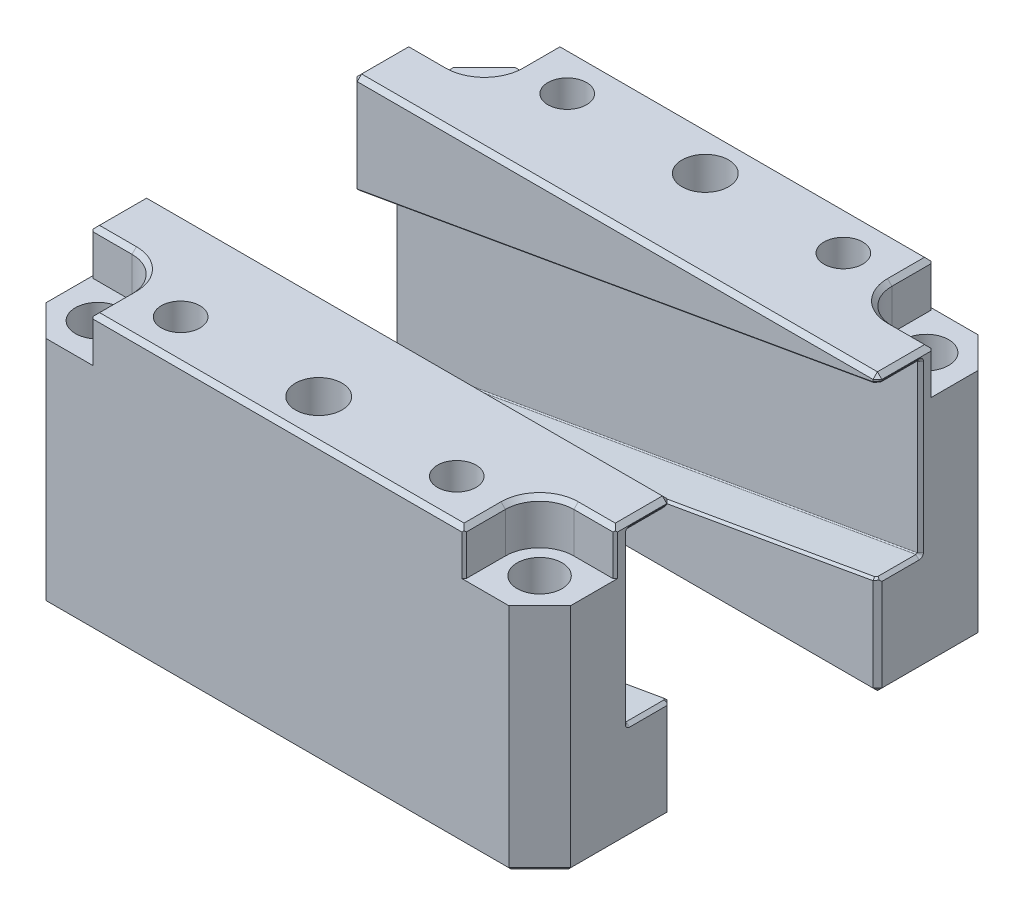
SolidWorks part; units mm, degrees
ref_plane "Front Plane" through (0, 0, 0) normal (0, 0, 1) x (1, 0, 0)
ref_plane "Top Plane" through (0, 0, 0) normal (0, 1, 0) x (1, 0, 0)
ref_plane "Right Plane" through (0, 0, 0) normal (1, 0, 0) x (0, 0, -1)
sketch "Sketch1" plane through (0, 0, 0) normal (1, 0, 0) x (0, 0, -1)
  line L0 (-23.7109, 0) -> (-23.7109, 63.5)
  line L1 (-23.7109, 63.5) -> (-53.9496, 63.5)
  line L2 (-53.9496, 63.5) -> (-53.9496, 0)
  line L3 (-53.9496, 0) -> (-23.7109, 0)
  line L4 (0, 48.255) -> (0, -16.2311) construction
  dimension "D1" = 47.4218
  dimension "D2" = 63.5
  dimension "D3" = 107.8992
  dimension "D4" = 30.2387
extrude "Boss-Extrude1" add sketch "Sketch1" along normal mid plane 120.65
hole_wizard "CBORE for 3/8 Socket Head Cap Screw3" positions "Sketch4" profile "Sketch3" counterbore size "3/8" standard "ANSI Inch"
sketch "Sketch4" plane through (0, 63.5, 0) normal (0, 1, 0) x (1, 0, 0)
  line L0 (0, 7.4267) -> (0, -36.2312) construction
  line L2 (-19.6518, 0) -> (14.0148, 0) construction
  point P0 (-50.8, -44.45)
  point P11 (50.8, -44.45)
  dimension "D1" = 101.6
  dimension "D2" = 88.9
sketch "Sketch3" plane through (-50.8, 63.5, 44.45) normal (1, 0, 0) x (0, 0, 1)
  line L0 (0, 0) -> (0, 63.5)
  line L1 (0, 63.5) -> (5.1587, 63.5)
  line L3 (5.1587, 63.5) -> (5.1587, 10.287)
  line L4 (5.1587, 10.287) -> (7.874, 10.287)
  line L5 (7.874, 10.287) -> (7.874, 0)
  line L7 (7.874, 0) -> (0, 0)
  line L11 (0, -6.35) -> (0, 107.95) construction
  dimension "Thru Hole Dia." = 10.3175
  dimension "Thru Hole Depth" = 63.5
  dimension "C'Bore Dia." = 15.748
  dimension "C'Bore Depth" = 10.287
hole_wizard "1/2-13 Tapped Hole1" positions "Sketch6" profile "Sketch5" tap size "1/2-13" standard "ANSI Inch"
sketch "Sketch6" plane through (0, 63.5, 0) normal (0, 1, 0) x (1, 0, 0)
  line L0 (0, 2.7703) -> (0, -32.9614) construction
  line L2 (-8.3627, 0) -> (4.6629, 0) construction
  line L4 (50.8, -44.45) -> (-50.8, -44.45) construction
  point P2 (0, -44.45)
sketch "Sketch5" plane through (0, 63.5, 44.45) normal (1, 0, 0) x (0, 0, 1)
  line L0 (0, 0) -> (0, 38.3985)
  line L1 (0, 38.3985) -> (5.3581, 35.179)
  line L2 (5.3581, 35.179) -> (5.3581, 0)
  line L5 (5.3581, 0) -> (0, 0)
  line L10 (0, 38.3985) -> (-5.3581, 35.179) construction
  line L11 (0, -6.35) -> (0, 107.95) construction
  dimension "Tap Drill Dia." = 10.7163
  dimension "Tap Drill Depth" = 35.179
  dimension "Drill Angle" = 118
chamfer "Chamfer1" distance 7.112 angle 45 2 edges at (60.325, 31.75, 53.9496) (-60.325, 31.75, 53.9496)
ref_plane "Plane3" through (0, 0, 44.45) normal (0, 0, 1) x (1, 0, 0)
sketch "Sketch17" plane through (0, 0, 44.45) normal (0, 0, 1) x (1, 0, 0)
  line L0 (-36.195, 63.5) -> (-36.195, 22.7968)
  line L1 (-36.195, 22.7968) -> (-36.5125, 22.606)
  line L2 (-36.5125, 22.606) -> (-36.5125, 0)
  line L3 (-36.5125, 0) -> (-31.75, 0)
  line L4 (-31.75, 0) -> (-31.75, 63.5)
  line L5 (-31.75, 63.5) -> (-36.195, 63.5)
  line L6 (-31.75, 71.3814) -> (-31.75, -4.206) construction
  line L7 (53.213, 0) -> (-53.213, 0) construction
  line L8 (53.213, 63.5) -> (-53.213, 63.5) construction
  line L9 (0, 0) -> (0, 70.256) construction
  dimension "D1" = 22.606
  dimension "D2" = 59
  dimension "D3" = 9.525
  dimension "D4" = 8.89
  dimension "D5" = 63.5
revolve "Cut-Revolve2" cut sketch "Sketch17" angle 360 about L6
mirror "Mirror1" about plane through (0, 0, 0) normal (1, 0, 0) of "Cut-Revolve2"
sketch "Sketch8" plane through (0, 63.5, 0) normal (0, 1, 0) x (1, 0, 0)
  line L0 (-50.8, -36.576) -> (-60.325, -36.576)
  line L2 (-60.325, -23.7109) -> (-60.325, -46.8376) construction
  line L3 (-60.325, -36.576) -> (-60.325, -53.9496)
  line L4 (-60.325, -53.9496) -> (-42.926, -53.9496)
  line L5 (53.213, -53.9496) -> (-53.213, -53.9496) construction
  line L6 (-42.926, -53.9496) -> (-42.926, -44.45)
  line L7 (0, -17.5035) -> (0, -67.3559) construction
  line L8 (42.926, -53.9496) -> (42.926, -44.45)
  line L9 (60.325, -53.9496) -> (42.926, -53.9496)
  line L10 (60.325, -36.576) -> (60.325, -53.9496)
  line L11 (50.8, -36.576) -> (60.325, -36.576)
  circle A0 centre (-50.8, -44.45) radius 7.874 construction
  circle A1 centre (-50.8, -44.45) radius 7.874 construction
  arc A2 (-42.926, -44.45) -> (-50.8, -36.576) centre (-50.8, -44.45) ccw
  arc A3 (42.926, -44.45) -> (50.8, -36.576) centre (50.8, -44.45) cw
extrude "Cut-Extrude3" cut sketch "Sketch8" against normal up to surface (10.287 mm away)
sketch "Sketch9" plane through (0, 0, 23.7109) normal (0, 0, -1) x (-1, 0, 0)
  line L0 (0, 63.5) -> (0, 0) construction
  line L1 (-60.325, 63.5) -> (60.325, 63.5) construction
  line L2 (60.325, 0) -> (60.325, 63.5) construction
  line L3 (-60.325, 61.6792) -> (60.325, 40.4054)
  line L4 (-60.325, 61.6792) -> (-60.325, 23.0946)
  line L5 (-60.325, 23.0946) -> (60.325, 1.8208)
  line L6 (60.325, 40.4054) -> (60.325, 1.8208)
  line L7 (-60.325, 61.6792) -> (60.325, 1.8208) construction
  line L8 (-60.325, 23.0946) -> (60.325, 40.4054) construction
  line L9 (12.9005, 31.75) -> (-13.5117, 31.75) construction
  point P5 (0, 31.75)
  dimension "D1" = 37.9984
  dimension "D2" = 10
extrude "Cut-Extrude4" cut sketch "Sketch9" against normal offset from surface (9.8425 mm away) 33.5534
hole_wizard "1/2-13 Tapped Hole2" positions "Sketch11" profile "Sketch10" tap size "1/2-13" standard "ANSI Inch"
sketch "Sketch11" plane through (0, 0, 0) normal (0, -1, 0) x (-1, 0, 0)
  point P0 (50.8, -44.45)
  point P3 (-50.8, -44.45)
sketch "Sketch10" plane through (-50.8, 0, 44.45) normal (1, 0, 0) x (0, 0, -1)
  line L0 (0, 0) -> (0, 38.3985)
  line L1 (0, 38.3985) -> (5.3581, 35.179)
  line L2 (5.3581, 35.179) -> (5.3581, 0)
  line L5 (5.3581, 0) -> (0, 0)
  line L10 (0, 38.3985) -> (-5.3581, 35.179) construction
  line L11 (0, -6.35) -> (0, 107.95) construction
  dimension "Tap Drill Dia." = 10.7163
  dimension "Tap Drill Depth" = 35.179
  dimension "Drill Angle" = 118
ref_plane "Plane1" through (-5.4296, 30.7926, 0) normal (-0.1736, 0.9848, 0) x (0.9848, 0.1736, 0)
fillet "Fillet1" radius 0.254 2 edges at (0, 12.4577, 33.5534) (0, 51.0423, 33.5534)
chamfer "Chamfer2" distance 1.016 angle 45 20 edges at (0, 0, 23.7109) (60.325, 11.5473, 23.7109) (60.325, 0, 35.2742) (56.769, 0, 50.3936) (0, 0, 53.9496) (-56.769, 0, 50.3936) (-60.325, 0, 35.2742) (-60.325, 0.9104, 23.7109) (-45.2322, 63.5, 38.8822) (-60.325, 63.5, 30.1434) (-60.325, 51.9527, 23.7109) (0, 63.5, 23.7109) (0, 63.5, 53.9496) (45.2322, 63.5, 38.8822) (60.325, 63.5, 30.1434) (60.325, 62.5896, 23.7109) (-42.926, 63.5, 49.1998) (-55.5625, 63.5, 36.576) (42.926, 63.5, 49.1998) (55.5625, 63.5, 36.576)
chamfer "Chamfer3" distance 0.508 angle 45 20 edges at (-59.817, 1.9104, 24.2189) (0, 12.4577, 23.7109) (59.817, 23.0051, 24.2189) (-60.325, 1.8208, 29.0132) (60.325, 23.0946, 29.0132) (-60.325, 1.8963, 33.479) (60.325, 23.1702, 33.479) (-60.325, 21.1131, 33.5534) (60.325, 42.3869, 33.5534) (-60.325, 40.3298, 33.479) (60.325, 61.6037, 33.479) (-60.325, 40.4054, 29.0132) (-59.817, 40.4949, 24.2189) (0, 51.0423, 23.7109) (59.817, 61.5896, 24.2189) (60.325, 61.6792, 29.0132) (60.325, 57.8485, 36.576) (42.926, 57.8485, 53.9496) (-42.926, 57.8485, 53.9496) (-60.325, 57.8485, 36.576)
ref_plane "Plane2" through (38.1, 0, 0) normal (1, 0, 0) x (0, 0, -1)
sketch "Sketch18" plane through (38.1, 0, 0) normal (1, 0, 0) x (0, 0, -1)
  line L0 (-31.75, 0) -> (-31.75, 7.2507)
  line L1 (-24.7269, 0) -> (-46.4168, 0) construction
  line L2 (-31.75, 7.2507) -> (-29.75, 6.096)
  line L3 (-29.75, 6.096) -> (-29.75, 0)
  line L4 (-29.75, 0) -> (-31.75, 0)
  line L5 (-31.75, 0) -> (-31.75, 14.436) construction
  line L6 (-44.45, 35.8013) -> (-44.45, -35.8013) construction
  dimension "D1" = 12.7
  dimension "D2" = 4
  dimension "D3" = 6.096
  dimension "D4" = 60
revolve "Cut-Revolve3" cut sketch "Sketch18" angle 360 about L5
chamfer "Chamfer4" distance 0.508 angle 45 2 edges at (36.5125, 0, 44.45) (-36.5125, 0, 44.45)
mirror "Mirror3" about plane through (0, 0, 0) normal (0, 0, 1)
